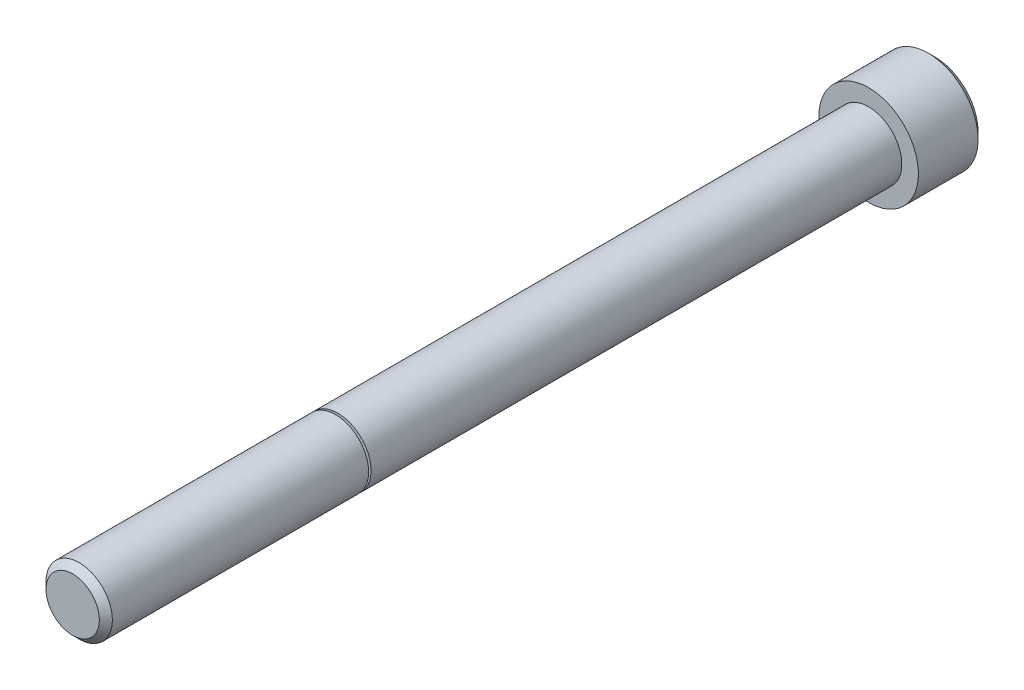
SolidWorks part; units mm, degrees
ref_plane "Front" through (0, 0, 0) normal (0, 0, 1) x (1, 0, 0)
ref_plane "Top" through (0, 0, 0) normal (0, 1, 0) x (1, 0, 0)
ref_plane "Right" through (0, 0, 0) normal (1, 0, 0) x (0, 0, -1)
sketch "Logo3_Revol_Axis" plane through (0, 0, 0) normal (0, 1, 0) x (1, 0, 0)
  line L0 (0, -43.5172) -> (0, 43.5172) construction
sketch "Logo3_bib1" plane through (0, 0, 0) normal (0, -1, 0) x (-1, 0, 0)
  line L0 (0, -76.2) -> (0, 6.35)
  line L1 (0, 6.35) -> (4.1275, 6.35)
  line L2 (4.7625, 5.715) -> (4.7625, 0)
  line L3 (4.7625, 0) -> (3.175, 0)
  line L4 (3.175, 0) -> (3.175, -50.81)
  line L5 (3.175, -75.5777) -> (2.5527, -76.2)
  line L6 (2.5527, -76.2) -> (0, -76.2)
  line L7 (3.175, -50.81) -> (2.6661, -50.81)
  line L8 (2.6593, -50.8488) -> (3.175, -51.0365)
  line L9 (3.175, -51.0365) -> (3.175, -75.5777)
  line L10 (0, 10.5852) -> (0, -63.2873) construction
  line L11 (4.1275, 6.35) -> (4.7625, 5.715)
  arc A1 (2.6661, -50.81) -> (2.6593, -50.8488) centre (2.6661, -50.83) ccw
  point P17 (2.5527, -50.81)
  point P19 (4.7625, 6.35)
revolve "Revolve1" add sketch "Logo3_bib1" angle 360 about L10
sketch "Logo3_bib2" plane through (0, 0, -6.35) normal (0, 0, -1) x (1, 0, 0)
  line L1 (2.7496, 0) -> (1.3748, 2.3813)
  line L2 (1.3748, 2.3813) -> (-1.3748, 2.3813)
  line L3 (-1.3748, 2.3813) -> (-2.7496, 0)
  line L4 (-2.7496, 0) -> (-1.3748, -2.3813)
  line L5 (-1.3748, -2.3813) -> (1.3748, -2.3813)
  line L6 (1.3748, -2.3813) -> (2.7496, 0)
  circle A0 centre (0, 0) radius 2.3812 construction
  dimension "Logo3_c1" = 4.7625
extrude "Cut-Extrude1" cut sketch "Logo3_bib2" against normal blind 3.175
equation "\"DIA2@Logo3_bib1\" = \"Logo3_d1-pas@Logo3_bib1\""
equation "\"LGT1@Logo3_bib1\" = \"Logo3_d1@Logo3_bib1\""
equation "\"D1@Cut-Extrude1\" = \"Logo3_d1@Logo3_bib1\"/2."
equation "\"D2@Cosmetic Thread1\" = \"Logo3_d1-pas@Logo3_bib1\""
equation "\"D5@Logo3_bib1\"=\"Logo3_d1@Logo3_bib1\"*.1"
